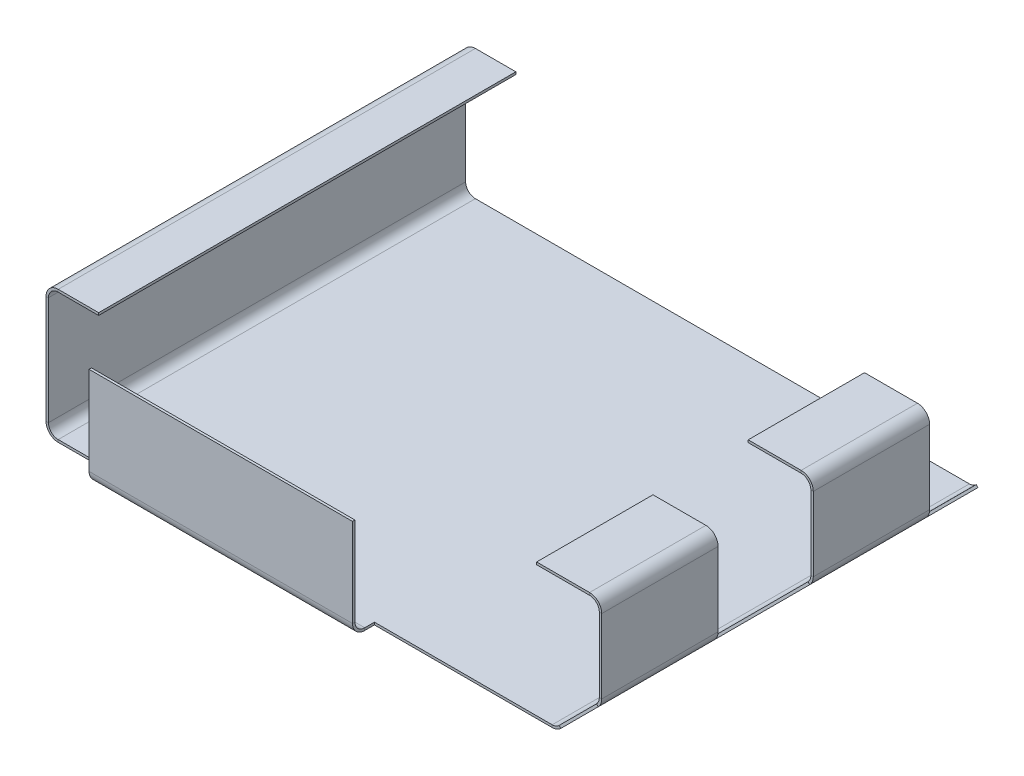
SolidWorks part; units mm, degrees
ref_plane "Front" through (0, 0, 0) normal (0, 0, 1) x (1, 0, 0)
ref_plane "Top" through (0, 0, 0) normal (0, 1, 0) x (1, 0, 0)
ref_plane "Right" through (0, 0, 0) normal (1, 0, 0) x (0, 0, -1)
sketch "Sketch1" plane through (0, 0, 0) normal (0, 1, 0) x (1, 0, 0)
  line L0 (36.1615, -41.3303) -> (74.6189, -41.3303)
  line L1 (-67.1383, 44.3225) -> (74.6189, 44.3225)
  line L2 (-67.1383, 44.3225) -> (-67.1383, -41.3303)
  line L3 (-67.1383, -41.3303) -> (-17.9266, -41.3303)
  line L4 (74.6189, 44.3225) -> (74.6189, 33.655)
  line L5 (0, 0) -> (119.2674, 0) construction
  line L6 (-17.9266, -41.3303) -> (-17.9266, -65.4023)
  line L7 (-17.9266, -65.4023) -> (36.1615, -65.4023)
  line L8 (36.1615, -41.3303) -> (36.1615, -65.4023)
  line L9 (74.6189, 33.655) -> (106.5516, 33.655)
  line L11 (74.6189, 9.7742) -> (106.5516, 9.7742)
  line L12 (106.5516, 33.655) -> (106.5516, 9.7742)
  line L13 (106.5516, -33.655) -> (106.5516, -9.7742)
  line L14 (74.6189, -9.7742) -> (106.5516, -9.7742)
  line L15 (74.6189, 9.7742) -> (74.6189, -9.7742)
  line L16 (74.6189, -33.655) -> (106.5516, -33.655)
  line L17 (74.6189, -33.655) -> (74.6189, -41.3303)
sheet metal parameters "Sheet-Metal2" thickness 0.5 parameters "D1"=2
base flange "Base-Flange1" sketch "Sketch1" thickness 0.5 reverse thickness direction yes parameters "D1"=2
sketch "Sketch11" plane through (0, 0.5, 0) normal (0, 1, 0) x (-1, 0, 0)
  line L0 (-74.6189, -33.655) -> (-74.6189, 33.655)
  line L1 (-93.7245, 33.655) -> (-93.7245, -33.655)
  line L2 (30.7269, -44.3225) -> (30.7269, 41.3303)
  line L3 (-74.6189, -44.3225) -> (67.1383, -44.3225) construction
  line L4 (67.1383, 41.3303) -> (17.9266, 41.3303) construction
  line L5 (56.8671, -44.3225) -> (56.8671, 41.3303)
  line L6 (-74.6189, 33.655) -> (-106.5516, 33.655) construction
  line L7 (-106.5516, -33.655) -> (-74.6189, -33.655) construction
  line L8 (17.9266, 45.2858) -> (-36.1615, 45.2858)
  line L9 (17.9266, 41.3303) -> (17.9266, 65.4023) construction
  line L10 (-36.1615, 65.4023) -> (-36.1615, 41.3303) construction
sketched bend "Sketched Bend3" parameters "D1"=0
bend "SketchBend5" bend radius 2 bend angle 90 parameters "D5"=1
bend "SketchBend6" bend radius 0 bend angle 90 parameters "D5"=2
bend "SketchBend7" bend radius 0 bend angle 90 parameters "D5"=3
bend "SketchBend12" bend radius 0 bend angle 90 parameters "D5"=8
bend "SketchBend13" bend radius 0 bend angle 90 parameters "D5"=13
flat pattern "Flat-Pattern2"
sketch "Bend-Lines2" plane through (0, 0.5, 0) normal (0, 1, 0) x (-1, 0, 0)
  line L0 (-93.7245, -33.655) -> (-93.7245, 33.655) construction
  line L1 (-36.1615, 45.2858) -> (17.9266, 45.2858) construction
  line L2 (56.8671, 41.3303) -> (56.8671, -44.3225) construction
  line L3 (30.7269, 41.3303) -> (30.7269, -44.3225) construction
  line L4 (-74.6189, -44.3225) -> (-74.6189, 41.3303) construction
bend of the flat pattern "Flatten-<SketchBend5>1"
bend of the flat pattern "Flatten-<SketchBend6>1"
bend of the flat pattern "Flatten-<SketchBend7>1"
bend of the flat pattern "Flatten-<SketchBend12>1"
bend of the flat pattern "Flatten-<SketchBend13>1"
